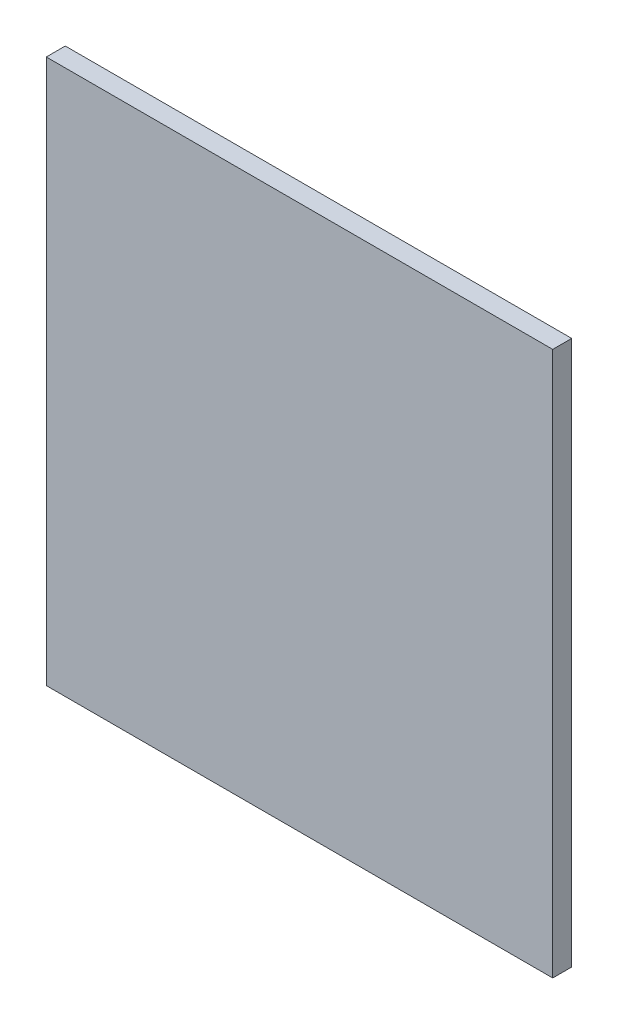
SolidWorks part; units mm, degrees
ref_plane "Alzado" through (0, 0, 0) normal (0, 0, 1) x (1, 0, 0)
ref_plane "Planta" through (0, 0, 0) normal (0, 1, 0) x (1, 0, 0)
ref_plane "Vista lateral" through (0, 0, 0) normal (1, 0, 0) x (0, 0, -1)
sketch "Croquis1" plane through (0, 0, 0) normal (0, 0, 1) x (1, 0, 0)
  line L1 (-200, 215) -> (200, 215)
  line L2 (-200, 215) -> (-200, -215)
  line L3 (-200, -215) -> (200, -215)
  line L4 (200, 215) -> (200, -215)
  line L5 (-200, 215) -> (200, -215) construction
  line L6 (-200, -215) -> (200, 215) construction
  point P0 (0, 0)
  dimension "D1" = 430
  dimension "D2" = 400
extrude "Saliente-Extruir1" add sketch "Croquis1" along normal blind 15
